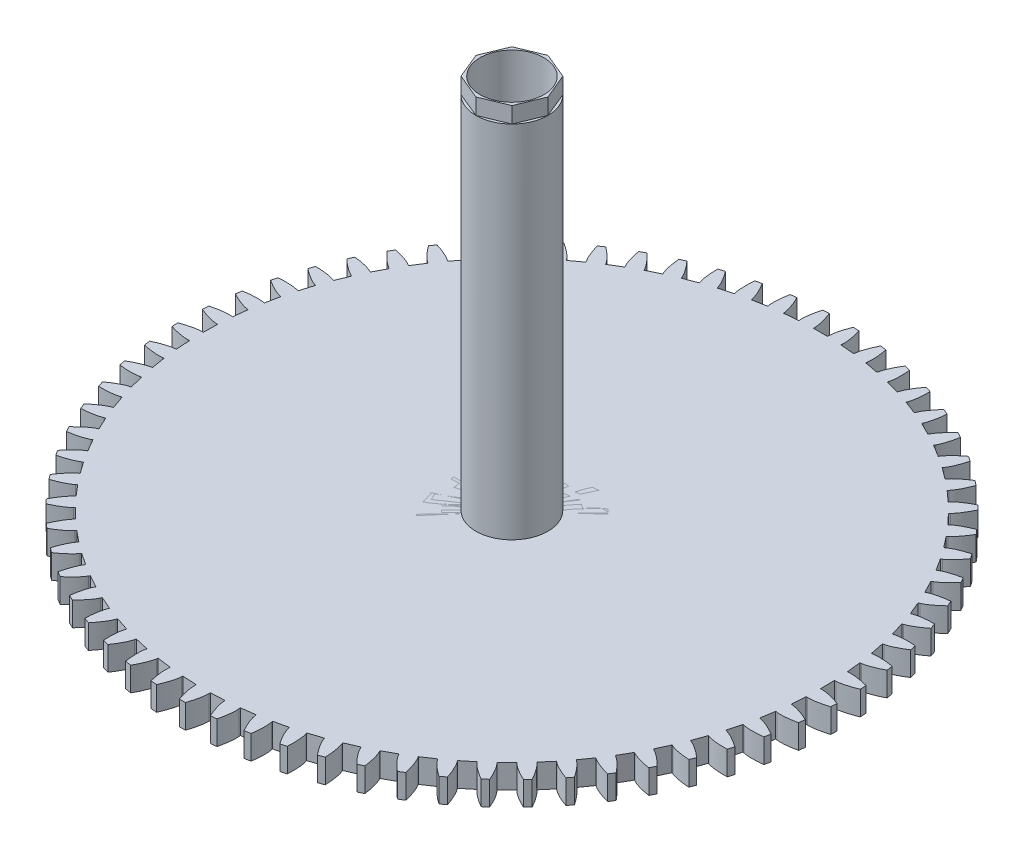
SolidWorks part; units mm, degrees
ref_plane "Front Plane" through (0, 0, 0) normal (0, 0, 1) x (1, 0, 0)
ref_plane "Top Plane" through (0, 0, 0) normal (0, 1, 0) x (1, 0, 0)
ref_plane "Right Plane" through (0, 0, 0) normal (1, 0, 0) x (0, 0, -1)
sketch "Sketch1" plane through (0, 0, 0) normal (0, 1, 0) x (1, 0, 0)
  line L0 (0, 0) -> (0, 19.3726) construction
  line L1 (0, 0) -> (-19.3726, 0) construction
  line L2 (0, 0) -> (-20.5847, -0.4687) construction
  line L3 (0, 0) -> (-19.3526, -0.8817) construction
  line L4 (0, 0) -> (-19.2924, -1.7616) construction
  circle A0 centre (0, 0) radius 20.01 construction
  circle A1 centre (0, 0) radius 19.3726 construction
  circle A2 centre (0, 0) radius 19.285 construction
  circle A3 centre (0, 0) radius 20.59 construction
  spline S0 degree 4 poles (-19.3726, 0) (-19.4031, 0) (-19.4885, -0.0031) (-19.6494, -0.0214) (-19.9094, -0.0687) (-20.2357, -0.1543) (-20.6496, -0.2935) (-21.1251, -0.4935) (-21.6322, -0.7502) (-22.1648, -1.0676) (-22.6774, -1.4175) (-23.1695, -1.7955) (-23.6412, -2.1985) (-24.1893, -2.7148) (-24.8127, -3.3752) (-25.4883, -4.197) (-26.1888, -5.1944) (-26.8271, -6.2594) (-27.392, -7.3643) (-27.8237, -8.3616) (-28.1499, -9.232) (-28.3934, -9.9701) (-28.5711, -10.561) (-28.7726, -11.3165) (-28.9461, -12.0601) (-29.0938, -12.84) (-29.2376, -13.7311) (-29.3339, -14.5513) (-29.4001, -15.2379) (-29.4468, -16.1062) (-29.4623, -16.5496) (-29.4725, -17.1758) (-29.468, -17.6402) (-29.4597, -18.0624) (-29.4494, -18.2985) (-29.4441, -18.4363) knots 0 0 0 0 0 0.005377 0.015084 0.028532 0.04661 0.064855 0.092111 0.119476 0.146842 0.174209 0.201575 0.228941 0.256307 0.307035 0.361767 0.4165 0.471232 0.525964 0.580697 0.608063 0.635429 0.662795 0.690161 0.744894 0.77226 0.799626 0.854358 0.881725 0.909091 0.931818 0.954545 0.977273 1 1 1 1 1 construction
  spline S1 degree 4 poles (-19.3726, 0) (-19.4031, 0) (-19.4885, -0.0031) (-19.6494, -0.0214) (-19.9094, -0.0687) (-20.2357, -0.1543) (-20.6496, -0.2935) (-21.1251, -0.4935) (-21.6322, -0.7502) (-22.1648, -1.0676) (-22.6774, -1.4175) (-23.1695, -1.7955) (-23.6412, -2.1985) (-24.1893, -2.7148) (-24.8127, -3.3752) (-25.4883, -4.197) (-26.1888, -5.1944) (-26.8271, -6.2594) (-27.392, -7.3643) (-27.8237, -8.3616) (-28.1499, -9.232) (-28.3934, -9.9701) (-28.5711, -10.561) (-28.7726, -11.3165) (-28.9461, -12.0601) (-29.0938, -12.84) (-29.2376, -13.7311) (-29.3339, -14.5513) (-29.4001, -15.2379) (-29.4388, -15.9569) (-29.4504, -16.2336) (-29.4551, -16.3744) knots 0 0 0 0 0 0.005377 0.015084 0.028532 0.04661 0.064855 0.092111 0.119476 0.146842 0.174209 0.201575 0.228941 0.256307 0.307035 0.361767 0.4165 0.471232 0.525964 0.580697 0.608063 0.635429 0.662795 0.690161 0.744894 0.77226 0.799626 0.854358 0.881725 0.909091 0.909091 0.909091 0.909091 0.909091
  dimension "D1" = 41.18
  dimension "D2" = 40.02
  dimension "D3" = 38.7453
  dimension "D4" = 38.57
  dimension "D5" = 19.3726
  dimension "D6" = 1.304
  dimension "D7" = 2.609
  dimension "D8" = 5.217
sketch "Sketch2" plane through (0, 0, 0) normal (0, 1, 0) x (1, 0, 0)
  line L0 (0, 0) -> (-20.5847, -0.4687) construction
  line L1 (0, 0) -> (-20.5847, -0.4687) construction
  line L2 (0, 0) -> (-19.3526, -0.8817) construction
  line L3 (0, 0) -> (-19.3726, 0) construction
  line L4 (0, 0) -> (-19.2924, -1.7616) construction
  line L5 (0, 0) -> (-19.3526, -0.8817) construction
  line L6 (0, 0) -> (-19.3726, 0) construction
  line L7 (0, 0) -> (-19.2924, -1.7616) construction
  line L8 (-19.3526, -0.8817) -> (-19.265, -0.8777)
  line L9 (-19.265, -0.8777) -> (-19.2051, -1.7537)
  line L10 (-19.2051, -1.7537) -> (-19.2924, -1.7616) construction
  line L11 (-19.2051, -1.7537) -> (-1.9917, -0.1819)
  line L12 (-19.3726, 0) -> (-2, 0)
  circle A0 centre (0, 0) radius 19.285 construction
  circle A1 centre (0, 0) radius 19.3726 construction
  circle A2 centre (0, 0) radius 20.01 construction
  circle A3 centre (0, 0) radius 20.59 construction
  circle A4 centre (0, 0) radius 19.285 construction
  circle A5 centre (0, 0) radius 19.3726 construction
  circle A6 centre (0, 0) radius 20.01 construction
  circle A7 centre (0, 0) radius 20.59 construction
  arc A8 (-20.5794, -0.6592) -> (-20.5881, -0.2782) centre (0, 0) cw
  circle A11 centre (0, 0) radius 2 construction
  arc A12 (-2, 0) -> (-1.9917, -0.1819) centre (0, 0) ccw
  spline S0 degree 4 poles (-110.3594, -2998.3946) (-14.223, -60.4396) (-15.1226, -1.2588) (-17.6274, 0.3463) (-19.9094, -0.0687) (-20.2357, -0.1543) (-20.6496, -0.2935) (-21.1251, -0.4935) (-21.6322, -0.7502) (-22.1648, -1.0676) (-22.6774, -1.4175) (-23.1695, -1.7955) (-23.6412, -2.1985) (-24.1893, -2.7148) (-24.8127, -3.3752) (-25.4883, -4.197) (-26.1888, -5.1944) (-26.8271, -6.2594) (-27.392, -7.3643) (-27.8237, -8.3616) (-28.1499, -9.232) (-28.3934, -9.9701) (-28.5711, -10.561) (-28.7726, -11.3165) (-28.9461, -12.0601) (-29.0938, -12.84) (-29.2376, -13.7311) (-29.3339, -14.5513) (-29.6132, -17.445) (-29.5176, -24.4764) (-26.1179, 58.1896) (-127.4248, -3014.4767) knots -0.362518 -0.362518 -0.362518 -0.362518 -0.362518 0.005377 0.015084 0.028532 0.04661 0.064855 0.092111 0.119476 0.146842 0.174209 0.201575 0.228941 0.256307 0.307035 0.361767 0.4165 0.471232 0.525964 0.580697 0.608063 0.635429 0.662795 0.690161 0.744894 0.77226 0.799626 0.854358 0.881725 1.348954 1.348954 1.348954 1.348954 1.348954 only from (-19.3726, 0) to (-29.4551, -16.3744) construction
  spline S1 degree 4 poles (-19.3726, 0) (-19.4031, 0) (-19.4885, -0.0031) (-19.6494, -0.0214) (-19.9094, -0.0687) (-20.183, -0.1405) (-20.3997, -0.2102) (-20.5422, -0.2612) (-20.5881, -0.2782) knots 0 0 0 0 0 0.005377 0.015084 0.028532 0.04661 0.055247 0.055247 0.055247 0.055247 0.055247
  spline S2 degree 4 poles (-19.3526, -0.8817) (-19.383, -0.8831) (-19.4685, -0.8839) (-19.63, -0.8729) (-19.8919, -0.8375) (-20.1685, -0.7783) (-20.3881, -0.7185) (-20.5328, -0.674) (-20.5794, -0.6592) knots 0 0 0 0 0 0.005377 0.015084 0.028532 0.04661 0.055247 0.055247 0.055247 0.055247 0.055247
  point P21 (-19.265, -0.8777)
  point P24 (-19.2051, -1.7537)
  dimension "D2" = 4
extrude "Boss-Extrude1" add sketch "Sketch2" along normal blind 1.5
pattern_circular "CirPattern1" count 69 over 360 of "Boss-Extrude1"
sketch "Sketch3" plane through (0, 1.5, 0) normal (0, 1, 0) x (1, 0, 0)
  circle A0 centre (0, 0) radius 2
  circle A1 centre (0, 0) radius 2.25
  circle A2 centre (0, 0) radius 2 construction
  dimension "D1" = 0.25
extrude "Boss-Extrude2" add sketch "Sketch3" along normal blind 23.5
sketch "Sketch4" plane through (0, 25, 0) normal (0, 1, 0) x (1, 0, 0)
  line L1 (2.25, 0) -> (1.591, 1.591)
  line L2 (1.591, 1.591) -> (0, 2.25)
  line L3 (0, 2.25) -> (-1.591, 1.591)
  line L4 (-1.591, 1.591) -> (-2.25, 0)
  line L5 (-2.25, 0) -> (-1.591, -1.591)
  line L6 (-1.591, -1.591) -> (0, -2.25)
  line L7 (0, -2.25) -> (1.591, -1.591)
  line L8 (1.591, -1.591) -> (2.25, 0)
  circle A0 centre (0, 0) radius 2.25
  circle A1 centre (0, 0) radius 2.25 construction
extrude "Cut-Extrude1" cut sketch "Sketch4" against normal blind 1 contours L8 M1 | L1 M1 | L2 M1 | L3 M1 | L7 M1 | L6 M1 | L5 M1 | L4 M1
equation "\"Module\"= .58"
equation "\"Number of Teeth\"= 69"
equation "\"Pressure Angle\"= 14.5deg"
equation "\"Pitch Diameter\"= \"Number of Teeth\" * \"Module\""
equation "\"Circular Pitch\"= pi * \"Module\""
equation "\"Addendum\"= \"Module\""
equation "\"Dedendum\"= 1.25 * \"Module\""
equation "\"Base Diameter\"= \"Pitch Diameter\" * cos ( \"Pressure Angle\" )"
equation "\"Base Radius\"= \"Base Diameter\" / 2"
equation "\"Width\"= 1.5"
equation "\"Outside Diameter\"= \"Pitch Diameter\" + 2 * \"Addendum\""
equation "\"D1@Sketch1\"=\"Outside Diameter\""
equation "\"D3@Sketch1\"=\"Base Diameter\""
equation "\"Root Diameter\"= \"Pitch Diameter\" - 2 * \"Dedendum\""
equation "\"D4@Sketch1\"=\"Root Diameter\""
equation "\"Tooth Angle\"= 360 / \"Number of Teeth\""
equation "\"D6@Sketch1\"=\"Tooth Angle\"/4"
equation "\"D7@Sketch1\"=\"Tooth Angle\"/2"
equation "\"D8@Sketch1\"=\"Tooth Angle\""
equation "\"D2@Sketch1\" = \"Pitch Diameter\""
equation "\"Shaft Diameter\"= 4"
equation "\"D1@CirPattern1\" = \"Number of Teeth\""
equation "\"D2@Sketch2\"= \"Shaft Diameter\""
equation "\"D1@Boss-Extrude1\" = \"Width\""
